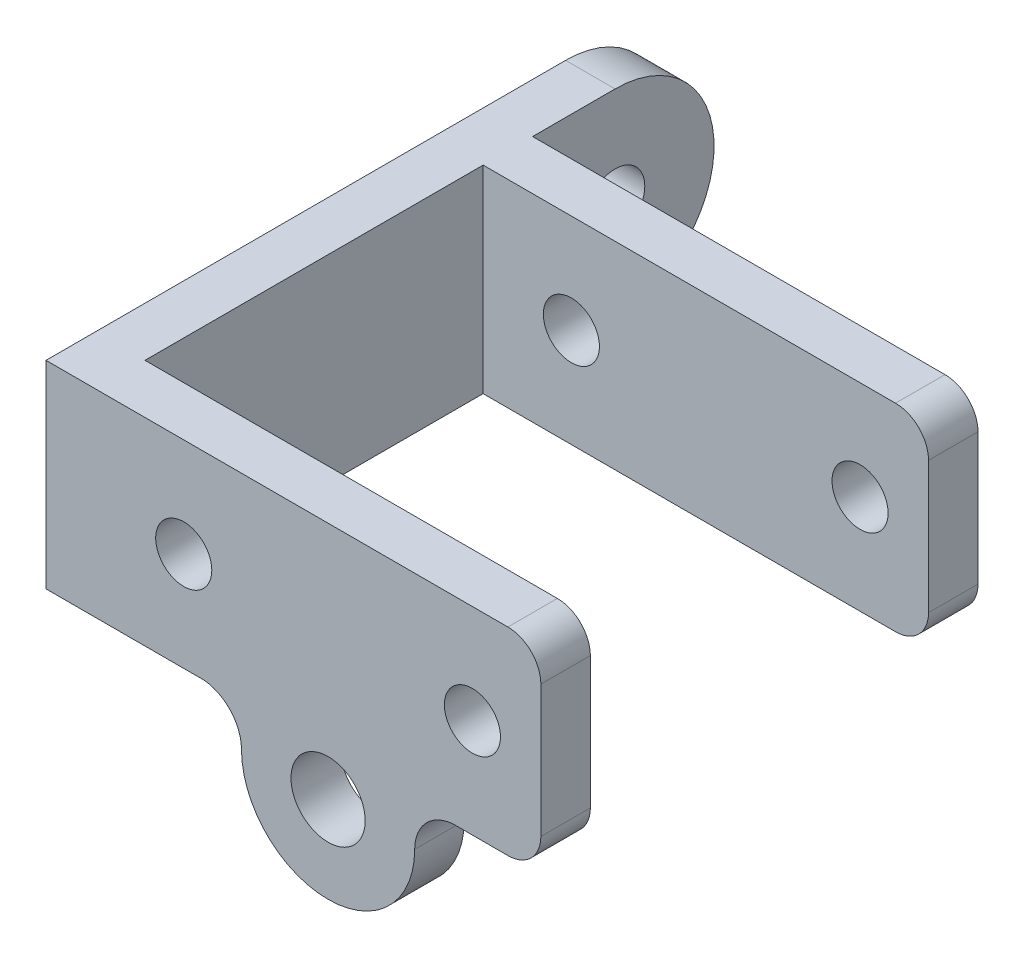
SolidWorks part; units mm, degrees
ref_plane "Front" through (0, 0, 0) normal (0, 0, 1) x (1, 0, 0)
ref_plane "Top" through (0, 0, 0) normal (0, 1, 0) x (1, 0, 0)
ref_plane "Right" through (0, 0, 0) normal (1, 0, 0) x (0, 0, -1)
sketch "Эскиз2" plane through (0, 0, 0) normal (0, 0, 1) x (1, 0, 0)
  line L1 (-15, 6) -> (15, 6)
  line L2 (-15, 6) -> (-15, -6)
  line L3 (-15, -6) -> (15, -6)
  line L4 (15, 6) -> (15, -6)
  line L5 (-15, 6) -> (15, -6) construction
  line L6 (-15, -6) -> (15, 6) construction
  point P0 (0, 0)
extrude "Бобышка-Вытянуть1" add sketch "Эскиз2" along normal blind 26.5
shell "Оболочка2" thickness 3
sketch "Эскиз4" plane through (0, 0, 26.5) normal (0, 0, 1) x (1, 0, 0)
  line L7 (2.1, 0) -> (2.1, -5.9919) construction
  circle A0 centre (-6.65, 0) radius 1.7
  circle A1 centre (10.85, 0) radius 1.7
extrude "Вырез-Вытянуть2" cut sketch "Эскиз4" against normal through all
sketch "Эскиз5" plane through (0, 0, 26.5) normal (0, 0, 1) x (1, 0, 0)
  line L0 (-4.95, 0) -> (49995.05, 0) construction
  line L4 (2.1, 0) -> (2.1, -50000) construction
  circle A4 centre (2.1, -8.5) radius 2.25
sketch "Эскиз6" plane through (0, 0, 26.5) normal (0, 0, 1) x (1, 0, 0)
  line L0 (-5.4335, -6) -> (9.6691, -6)
  arc A0 (-3.15, -8.5) -> (7.35, -8.5) centre (2.1, -8.5) ccw
  arc A1 (-3.15, -8.5) -> (-5.4335, -6) centre (-5.6603, -8.5) ccw
  arc A2 (7.35, -8.5) -> (9.6691, -6) centre (9.8571, -8.5) cw
extrude "Бобышка-Вытянуть2" add sketch "Эскиз6" against normal up to vertex
extrude "Вырез-Вытянуть3" cut sketch "Эскиз5" against normal up to vertex (3 mm away)
sketch "Эскиз7" plane through (-15, 0, 0) normal (-1, 0, 0) x (0, 0, 1)
  line L0 (0, 0) -> (-50000, 0) construction
  line L2 (-5, 6) -> (0, 6)
  line L3 (0, 6) -> (0, -6)
  line L4 (0, -6) -> (-5, -6)
  circle A0 centre (-5, 0) radius 1.8
  arc A1 (-5, 6) -> (-5, -6) centre (-5, 0) ccw
extrude "Бобышка-Вытянуть3" add sketch "Эскиз7" against normal up to surface (3 mm away)
fillet "Скругление1" radius 2 4 edges at (15, -6, 1.5) (15, 6, 1.5) (15, -6, 25) (15, 6, 25)
